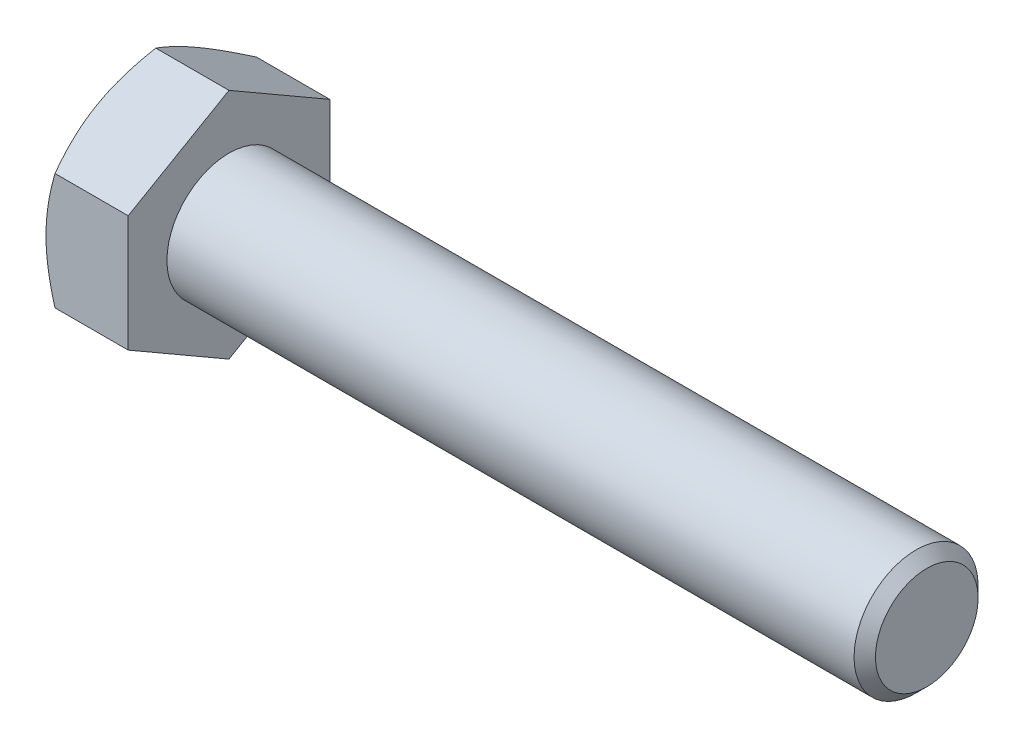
SolidWorks part; units mm, degrees
ref_plane "Plane1" through (0, 0, 0) normal (0, 0, 1) x (1, 0, 0)
ref_plane "Plane2" through (0, 0, 0) normal (0, 1, 0) x (1, 0, 0)
ref_plane "Plane3" through (0, 0, 0) normal (1, 0, 0) x (0, 0, -1)
sketch "Sketch1" plane through (0, 0, 0) normal (1, 0, 0) x (0, 0, -1)
  line L0 (6.5, 3.7528) -> (6.5, -3.7528)
  line L1 (-6.5, 3.7528) -> (-6.5, -3.7528)
  line L2 (6.5, -3.7528) -> (0, -7.5056)
  line L3 (0, -7.5056) -> (-6.5, -3.7528)
  line L4 (6.5, 3.7528) -> (0, 7.5056)
  line L5 (0, 7.5056) -> (-6.5, 3.7528)
  dimension "Width_flats" = 13
  dimension "D2" = 120
  dimension "D3" = 6.5
  dimension "D4" = 6.5
  dimension "D5" = 6.5
extrude "BaseHead" add sketch "Sketch1" along normal blind 5.3
sketch "BodySke" plane through (0, 0, 0) normal (0, 0, 1) x (1, 0, 0)
  line L1 (0, 0) -> (50.3, 0)
  line L2 (0, 0) -> (0, 4)
  line L4 (50.3, 0) -> (50.3, 3.3095)
  line L5 (5.3, 7.5056) -> (5.3, 3.7528) construction
  line L6 (50.3, 3.3095) -> (49.6095, 4)
  line L7 (0, 0) -> (110.49, 0) construction
  line L8 (50.3, -3.3095) -> (49.6095, -4) construction
  line L9 (0, 3.7528) -> (0, -3.7528) construction
  line L10 (6.55, 15.24) -> (6.55, -1.27) construction
  line L11 (5.3, 15.24) -> (5.3, -1.27) construction
  line L12 (5.3, 3.7528) -> (5.3, -3.7528) construction
  line L15 (0, 4) -> (49.6095, 4)
  dimension "Length" = 45
  dimension "Body_ch_ang" = 45
  dimension "Diameter" = 8
  dimension "Minor_dia" = 6.619
  dimension "Advance" = 1.25
  dimension "Thread_nom" = 45
revolve "BaseBody" add sketch "BodySke" angle 360 about L7
fillet "HeadFillet" [suppressed] radius 0.4
sketch "Sketch3" plane through (0, 0, 0) normal (0, 0, 1) x (1, 0, 0)
  line L0 (0, 6.5) -> (3.4673, 12.5056)
  line L1 (0, 7.5056) -> (0, 3.7528) construction
  line L2 (3.4673, 12.5056) -> (3.4673, 17.5056)
  line L3 (3.4673, 17.5056) -> (-10, 17.5056)
  line L4 (-10, 17.5056) -> (-10, 6.5)
  line L5 (-10, 6.5) -> (0, 6.5)
  line L6 (0, 0) -> (99.06, 0) construction
  line L7 (5.3, 7.5056) -> (0, 7.5056) construction
  dimension "D1" = 6.5
  dimension "D2" = 5
  dimension "D3" = 10
  dimension "D4" = 5
  dimension "Head_ch_ang" = 30
revolve "HeadChamfer" cut sketch "Sketch3" angle 360 about L6
sketch "ThdSchSke" plane through (0, 0, 0) normal (0, 0, 1) x (1, 0, 0)
  line L0 (6.55, -3.3095) -> (6.0665, -4)
  line L1 (6.55, -3.3095) -> (7.0335, -4)
  line L2 (7.0335, -4) -> (7.0335, -5)
  line L3 (-3.175, 0) -> (5.1513, 0) construction
  line L5 (7.0335, -5) -> (6.0665, -5)
  line L6 (6.0665, -5) -> (6.0665, -4)
  dimension "Thread_minor" = 6.619
  dimension "Diameter" = 8
  dimension "Start" = 6.55
  dimension "SideAngle" = 55
  dimension "VeeAngle" = 70
  dimension "Overcut" = 10
revolve "ThreadSchematic" [suppressed] cut sketch "ThdSchSke" angle 360 about L3
pattern_linear "ThdSchPat" [suppressed]
equation "\"D3@Sketch1\" = \"Width_flats@Sketch1\" / 2"
equation "\"D4@Sketch1\" = \"D3@Sketch1\""
equation "\"D5@Sketch1\" = \"D4@Sketch1\""
equation "\"Thread_minor@ThreadCosmetic\" = \"Minor_dia@BodySke\""
equation "\"D1@Sketch3\" = \"Width_flats@Sketch1\" / 2"
equation "\"Thread_length@ThreadCosmetic\" = ((sgn( (\"Length@BodySke\" - \"Advance@BodySke\" ) - \"Thread_nom@BodySke\" )-1)*( (\"Length@BodySke\" - \"Advance@BodySke\" ) - \"Thread_nom@BodySke\" ))/-2+ \"Thread_nom@BodySke\""
equation "\"Thread_minor@ThdSchSke\" = \"Minor_dia@BodySke\""
equation "\"Diameter@ThdSchSke\" = \"Diameter@BodySke\""
equation "\"Overcut@ThdSchSke\" = \"Diameter@BodySke\" * 1.25"
equation "\"Start@ThdSchSke\" = \"Head_ht@BaseHead\" + \"Length@BodySke\" - \"Thread_length@ThreadCosmetic\"  '---Non-countersunk---"
equation "\"Num_threads@ThdSchPat\" = int( \"Thread_length@ThreadCosmetic\" / \"Advance@BodySke\" + 0.999 )  + 1"
equation "\"Advance@ThdSchPat\" = \"Thread_length@ThreadCosmetic\" /  (\"Num_threads@ThdSchPat\" - 1) 'relax it"
equation "\"Num_threads@ThdSchPat\" = \"Num_threads@ThdSchPat\" - sgn( \"Num_threads@ThdSchPat\" - 1) '---chamfered tips only---"
